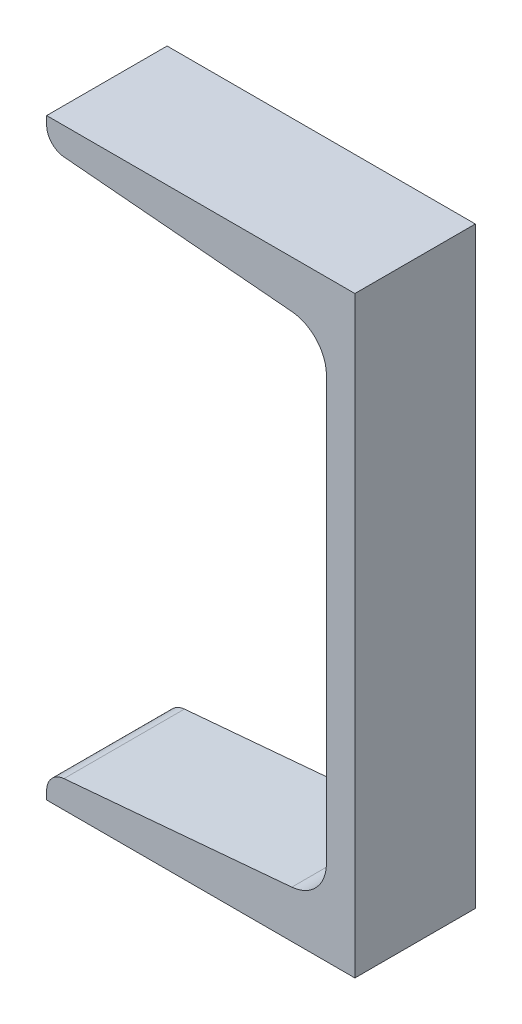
SolidWorks part; units mm, degrees
ref_plane "Front Plane" through (0, 0, 0) normal (0, 0, 1) x (1, 0, 0)
ref_plane "Top Plane" through (0, 0, 0) normal (0, 1, 0) x (1, 0, 0)
ref_plane "Right Plane" through (0, 0, 0) normal (1, 0, 0) x (0, 0, -1)
other "Configuration Table"
sketch "Sketch1" plane through (0, 0, 0) normal (0, 0, 1) x (1, 0, 0)
  line L0 (0, 84.7619) -> (0, -74.8933) construction
  line L1 (-65, 62.5) -> (0, 62.5)
  line L2 (-65, 62.5) -> (-65, 60.7462)
  line L3 (-65, -62.5) -> (0, -62.5)
  line L4 (0, 62.5) -> (0, -62.5)
  line L5 (-42.3074, 0) -> (60.8749, 0) construction
  line L6 (-65, -60.7462) -> (-65, -62.5)
  line L7 (-61.3486, 56.7615) -> (-13.3028, 52.558)
  line L9 (-61.3486, -56.7615) -> (-13.3028, -52.558)
  line L10 (-6, 44.5884) -> (-6, -44.5884)
  line L14 (-65, 21.4066) -> (-6, 21.4066) construction
  line L15 (-35.5, 62.5) -> (-35.5, 54.5) construction
  line L16 (-35.5, 54.5) -> (-35.5, 21.4066) construction
  arc A0 (-13.3028, 52.558) -> (-6, 44.5884) centre (-14, 44.5884) cw
  arc A1 (-13.3028, -52.558) -> (-6, -44.5884) centre (-14, -44.5884) ccw
  arc A4 (-65, 60.7462) -> (-61.3486, 56.7615) centre (-61, 60.7462) ccw
  arc A5 (-65, -60.7462) -> (-61.3486, -56.7615) centre (-61, -60.7462) cw
  point P18 (0, -62.5)
  point P27 (0, 62.5)
  point P34 (-65, 57.0809)
  point P37 (-65, -57.0809)
  dimension "Radius_root" = 8
  dimension "Radius_toe" = 4
  dimension "Depth" = 125
  dimension "Width" = 65
  dimension "Web_thickness" = 6
  dimension "Thickness" = 8
  dimension "D1" = 95
extrude "BaseSection" add sketch "Sketch1" along normal mid plane 25.4
